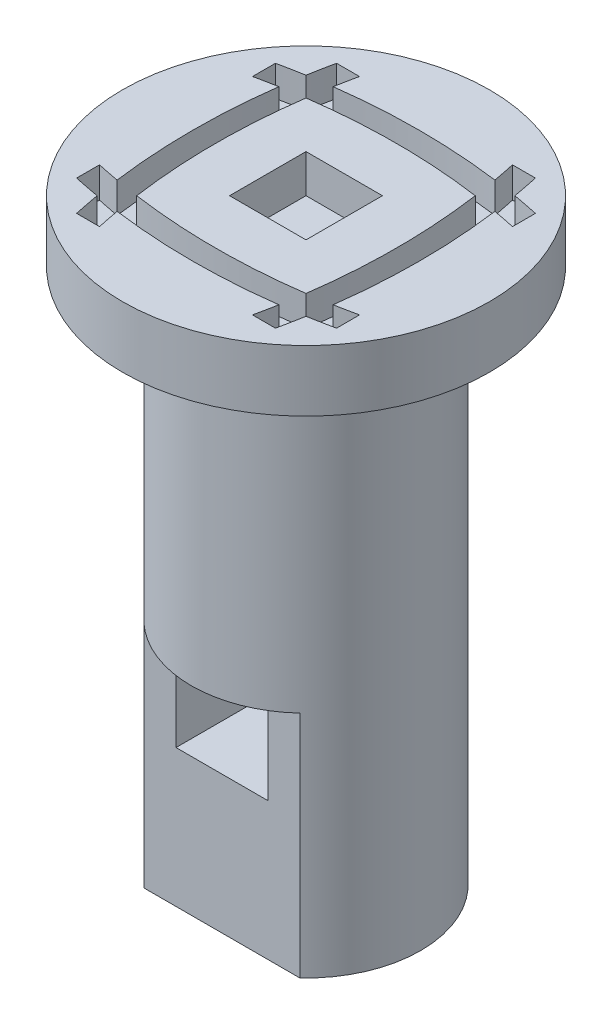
SolidWorks part; units mm, degrees
ref_plane "Front Plane" through (0, 0, 0) normal (0, 0, 1) x (1, 0, 0)
ref_plane "Top Plane" through (0, 0, 0) normal (0, 1, 0) x (1, 0, 0)
ref_plane "Right Plane" through (0, 0, 0) normal (1, 0, 0) x (0, 0, -1)
sketch "Sketch1" plane through (0, 0, 0) normal (0, 1, 0) x (1, 0, 0)
  circle A0 centre (0, 0) radius 24
  dimension "D1" = 48
extrude "Boss-Extrude1" add sketch "Sketch1" along normal blind 8
sketch "Sketch3" plane through (0, 8, 0) normal (0, 1, 0) x (1, 0, 0)
  line L1 (5, -5) -> (5, 5)
  line L2 (5, 5) -> (-5, 5)
  line L3 (-5, 5) -> (-5, -5)
  line L4 (-5, -5) -> (5, -5)
  dimension "D1" = 10
  dimension "D2" = 10
extrude "Cut-Extrude2" cut sketch "Sketch3" against normal blind 5
sketch "Sketch8" plane through (0, 0, 0) normal (0, -1, 0) x (1, 0, 0)
  circle A0 centre (0, 0) radius 15
  dimension "D1" = 30
extrude "Boss-Extrude3" add sketch "Sketch8" along normal blind 70
sketch "Sketch9" plane through (0, -70, 0) normal (0, -1, 0) x (1, 0, 0)
  line L0 (-10.198, 11) -> (10.198, 11)
  line L1 (0, 0) -> (0, 15)
  circle A0 centre (0, 0) radius 15 construction
  arc A1 (10.198, 11) -> (-10.198, 11) centre (0, 0) ccw
  dimension "D1" = 4
extrude "Cut-Extrude4" cut sketch "Sketch9" against normal blind 30 contours L0 A1
sketch "Sketch10" plane through (0, 0, 11) normal (0, 0, 1) x (1, 0, 0)
  line L0 (-6, -40) -> (-6, -52)
  line L1 (-10.198, -40) -> (10.198, -40) construction
  line L2 (-6, -52) -> (6, -52)
  line L3 (6, -52) -> (6, -40)
  line L4 (6, -40) -> (-6, -40)
  point P8 (0, -40)
  point P9 (0, -40)
  dimension "D1" = 12
  dimension "D2" = 12
extrude "Cut-Extrude5" cut sketch "Sketch10" against normal blind 12
sketch "Sketch11" plane through (0, 8, 0) normal (0, 1, 0) x (1, 0, 0)
  line L0 (10, 17) -> (13, 17)
  line L1 (10, -17) -> (13, -17)
  line L2 (17, -10) -> (17, -13)
  line L3 (-17, 10) -> (-17, 13)
  line L4 (17, 10) -> (17, 13)
  line L5 (-17, -10) -> (-17, -13)
  line L6 (-10, -17) -> (-13, -17)
  line L7 (-10, 17) -> (-13, 17)
  arc A0 (-17, 13) -> (-13.6534, 13.6534) centre (0, -65.1729) cw
  arc A1 (-17, 10) -> (-14.125, 10.5759) centre (0, -67.4052) cw
  arc A2 (13, 17) -> (13.6534, 13.6534) centre (-65.1729, 0) cw
  arc A3 (10, 17) -> (10.5759, 14.125) centre (-67.4052, 0) cw
  arc A4 (17, -13) -> (13.6534, -13.6534) centre (0, 65.1729) cw
  arc A5 (17, -10) -> (14.125, -10.5759) centre (0, 67.4052) cw
  arc A6 (-13, -17) -> (-13.6534, -13.6534) centre (65.1729, 0) cw
  arc A7 (-10, -17) -> (-10.5759, -14.125) centre (67.4052, 0) cw
  arc A8 (-10.5759, 14.125) -> (10.5759, 14.125) centre (0, -65.1729) cw
  arc A9 (-11.0681, 11.0681) -> (11.0681, 11.0681) centre (0, -67.4052) cw
  arc A10 (-13.6534, 13.6534) -> (-13, 17) centre (65.1729, 0) cw
  arc A11 (-10.5759, 14.125) -> (-10, 17) centre (67.4052, 0) cw
  arc A12 (11.0681, 11.0681) -> (11.0681, -11.0681) centre (-67.4052, 0) cw
  arc A13 (13.6534, 13.6534) -> (17, 13) centre (0, -65.1729) cw
  arc A14 (14.125, 10.5759) -> (14.125, -10.5759) centre (-65.1729, 0) cw
  arc A15 (14.125, 10.5759) -> (17, 10) centre (0, -67.4052) cw
  arc A16 (11.0681, -11.0681) -> (-11.0681, -11.0681) centre (0, 67.4052) cw
  arc A17 (10.5759, -14.125) -> (-10.5759, -14.125) centre (0, 65.1729) cw
  arc A18 (13.6534, -13.6534) -> (13, -17) centre (-65.1729, 0) cw
  arc A19 (10.5759, -14.125) -> (10, -17) centre (-67.4052, 0) cw
  arc A20 (-11.0681, -11.0681) -> (-11.0681, 11.0681) centre (67.4052, 0) cw
  arc A21 (-14.125, -10.5759) -> (-14.125, 10.5759) centre (65.1729, 0) cw
  arc A22 (-13.6534, -13.6534) -> (-17, -13) centre (0, 65.1729) cw
  arc A23 (-14.125, -10.5759) -> (-17, -10) centre (0, 67.4052) cw
  point P27 (0, 0)
  dimension "D6" = 80
  dimension "D7" = 79.25
  dimension "D1" = 4
  dimension "D2" = 3
  dimension "D3" = 3
  dimension "D4" = 34
extrude "Cut-Extrude6" cut sketch "Sketch11" against normal blind 4
